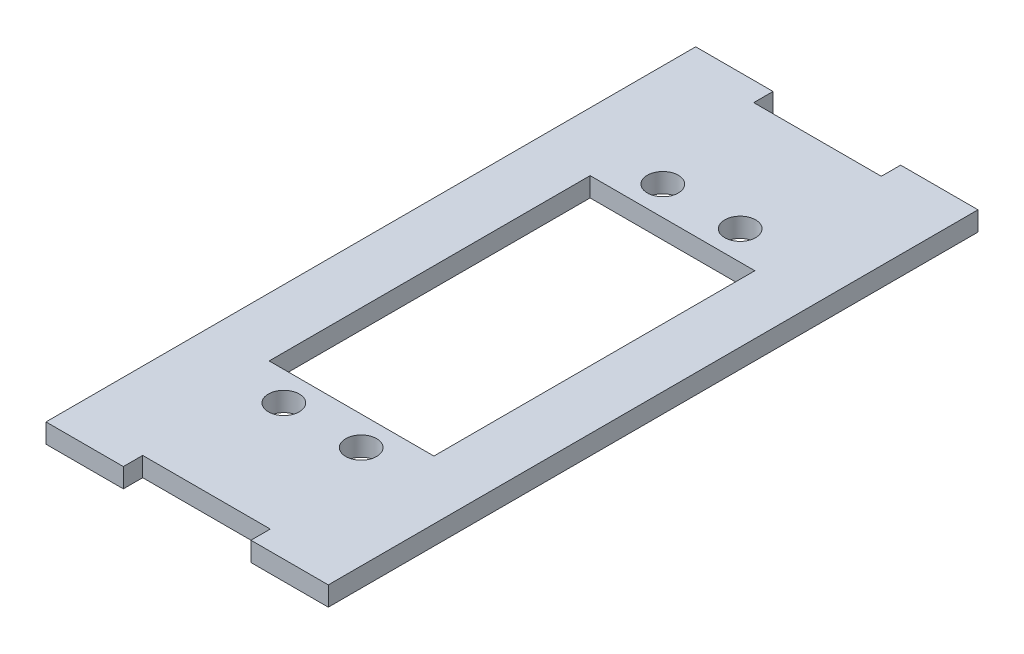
SolidWorks part; units mm, degrees
ref_plane "Front Plane" through (0, 0, 0) normal (0, 0, 1) x (1, 0, 0)
ref_plane "Top Plane" through (0, 0, 0) normal (0, 1, 0) x (1, 0, 0)
ref_plane "Right Plane" through (0, 0, 0) normal (1, 0, 0) x (0, 0, -1)
sketch "Sketch1" plane through (0, 0, 0) normal (0, -1, 0) x (1, 0, 0)
  line L0 (-10.2491, -10.3491) -> (-10.2491, 30.3491) construction
  line L1 (-18.2491, 52) -> (-8.2491, 52)
  line L2 (-18.2491, 52) -> (-18.2491, -32)
  line L3 (-18.2491, -32) -> (-8.2491, -32)
  line L4 (18.2491, 52) -> (18.2491, -32)
  line L5 (10.2491, 30.3491) -> (10.2491, -10.3491) construction
  line L6 (-3.5, 37) -> (3.5, 37) construction
  line L7 (9, -17) -> (6.5, -17) construction
  line L8 (-18.2491, 10) -> (18.2491, 10) construction
  line L10 (-8.2491, 52) -> (-8.2491, 49.5)
  line L11 (-8.2491, 49.5) -> (8.2491, 49.5)
  line L12 (8.2491, 52) -> (8.2491, 49.5)
  line L13 (8.2491, -32) -> (8.2491, -29.5)
  line L14 (-8.2491, -32) -> (-8.2491, -29.5)
  line L15 (-8.2491, -29.5) -> (8.2491, -29.5)
  line L16 (8.2491, 52) -> (18.2491, 52)
  line L17 (8.2491, -32) -> (18.2491, -32)
  line L18 (-10.2491, 30.3491) -> (10.2491, 30.3491) construction
  line L19 (-10.6491, 30.7491) -> (10.6491, 30.7491)
  line L20 (-10.6491, 30.7491) -> (-10.6491, -10.7491)
  line L21 (-10.6491, -10.7491) -> (10.6491, -10.7491)
  line L22 (10.6491, 30.7491) -> (10.6491, -10.7491)
  line L23 (10.2491, -10.3491) -> (-10.2491, -10.3491) construction
  circle A0 centre (5, -14.5) radius 2
  circle A1 centre (-5, -14.5) radius 2
  circle A2 centre (-5, 34.5) radius 2
  circle A3 centre (5, 34.5) radius 2
  dimension "D1" = 8
  dimension "D2" = 8
  dimension "D3" = 15
  dimension "D4" = 15
  dimension "D5" = 10
  dimension "D6" = 10
  dimension "D7" = 0.4
  dimension "D8" = 0.4
  dimension "D9" = 0.4
  dimension "D10" = 0.4
extrude "Boss-Extrude1" add sketch "Sketch1" along normal blind 2.5
